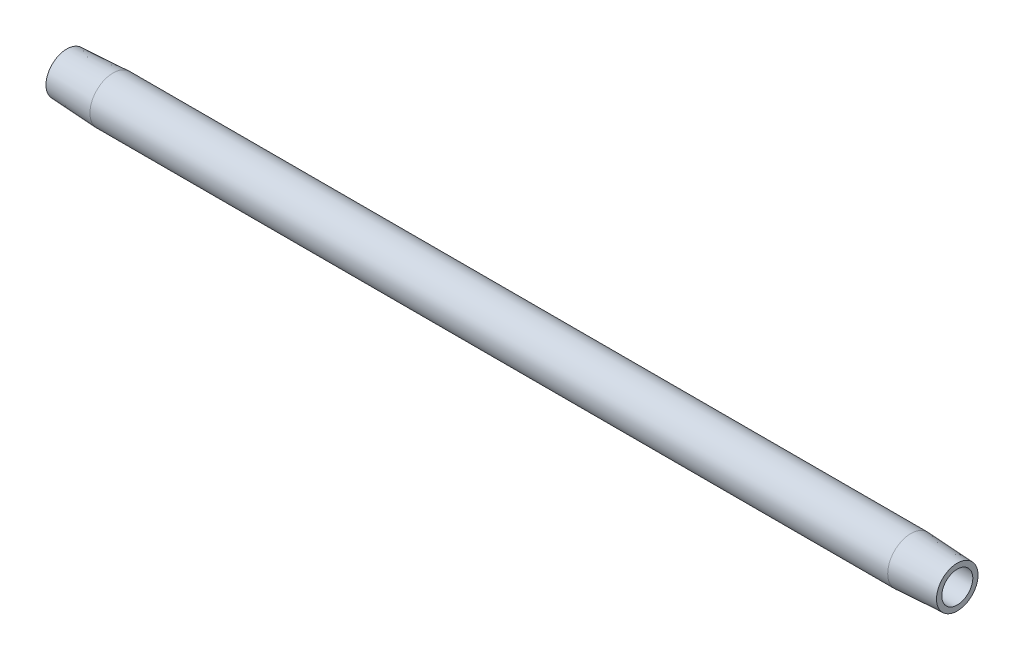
SolidWorks part; units mm, degrees
ref_plane "Front Plane" through (0, 0, 0) normal (0, 0, 1) x (1, 0, 0)
ref_plane "Top Plane" through (0, 0, 0) normal (0, 1, 0) x (1, 0, 0)
ref_plane "Right Plane" through (0, 0, 0) normal (1, 0, 0) x (0, 0, -1)
sketch "Sketch2" plane through (0, 0, 0) normal (0, 0, 1) x (1, 0, 0)
  line L0 (0.4761, 0) -> (50000.4761, 0) construction
  line L1 (0, -11.3625) -> (0, 49988.6375) construction
  line L7 (7.9375, 3.9687) -> (0, 3.5528)
  line L8 (144.4625, 3.9688) -> (7.9375, 3.9687)
  line L9 (152.4, 3.5528) -> (144.4625, 3.9688)
  line L10 (152.4, 2.6543) -> (152.4, 3.5528)
  line L11 (152.4, 2.6543) -> (0, 2.6543)
  line L12 (0, 3.5528) -> (0, 2.6543)
  dimension "D1" = 5.3086
  dimension "D2" = 7.9375
  dimension "D3" = 3
  dimension "D4" = 3
  dimension "D5" = 7.9375
  dimension "D6" = 7.9375
  dimension "D7" = 152.4
revolve "Revolve1" add sketch "Sketch2" angle 360 about L0
